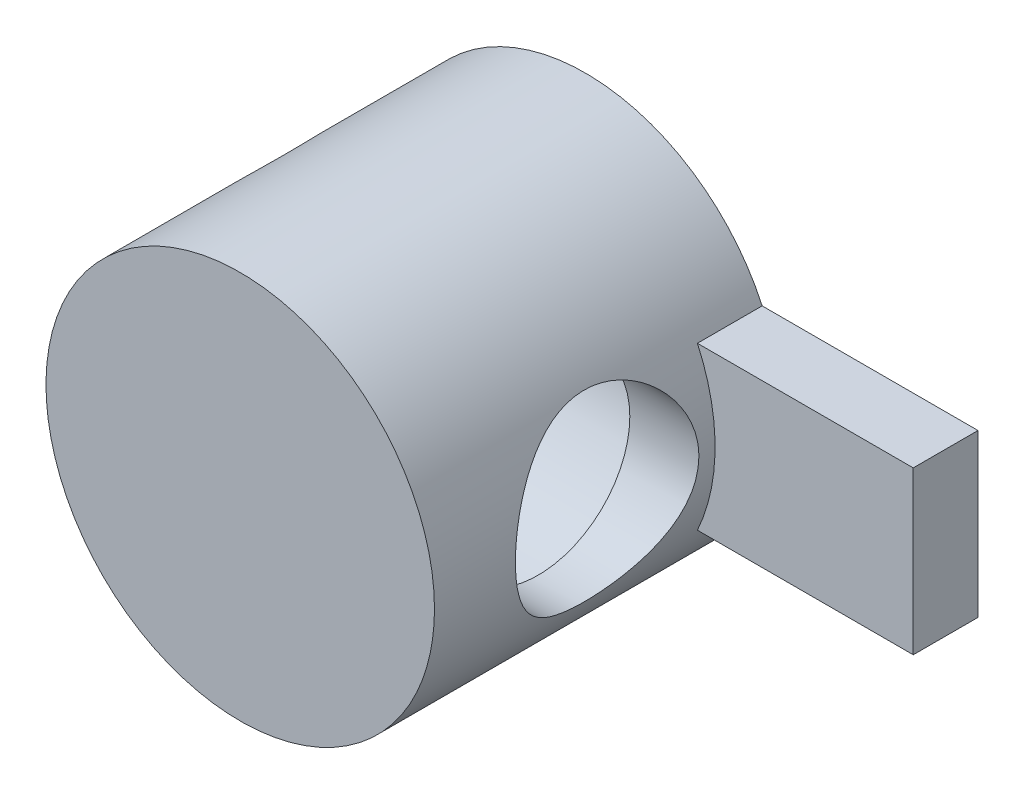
SolidWorks part; units mm, degrees
ref_plane "前视基准面" through (0, 0, 0) normal (0, 0, 1) x (1, 0, 0)
ref_plane "上视基准面" through (0, 0, 0) normal (0, 1, 0) x (1, 0, 0)
ref_plane "右视基准面" through (0, 0, 0) normal (1, 0, 0) x (0, 0, -1)
sketch "草图1" plane through (0, 0, 0) normal (0, 0, 1) x (1, 0, 0)
  circle A0 centre (0, 0) radius 9
  dimension "D1" = 18
extrude "凸台-拉伸1" add sketch "草图1" along normal mid plane 16
sketch "草图3" plane through (0, 0, -8) normal (0, 0, -1) x (-1, 0, 0)
  line L0 (0, 9) -> (0, -26.5793) construction
  line L1 (-16.154, 0) -> (26.2317, 0) construction
  line L4 (-8.1815, 3.75) -> (-18.1815, 3.75)
  line L5 (-18.1815, 3.75) -> (-18.1815, -3.75)
  line L6 (-18.1815, -3.75) -> (-8.1815, -3.75)
  circle A1 centre (0, 0) radius 9 construction
  arc A2 (-8.1815, 3.75) -> (-8.1815, -3.75) centre (0, 0) ccw
  dimension "D1" = 7.5
extrude "凸台-拉伸2" add sketch "草图3" against normal blind 3
sketch "草图4" plane through (0, 0, 0) normal (1, 0, 0) x (0, 0, -1)
  circle A0 centre (0, 0) radius 4.25
  dimension "D1" = 8.5
extrude "切除-拉伸1" cut sketch "草图4" against normal mid plane 20
sketch "草图5" plane through (0, 0, 0) normal (1, 0, 0) x (0, 0, -1)
  circle A0 centre (0, 0) radius 6.75
  dimension "D1" = 13.5
extrude "切除-拉伸2" cut sketch "草图5" against normal blind 20
sketch "草图6" plane through (0, 0, 0) normal (1, 0, 0) x (0, 0, -1)
  circle A0 centre (0, 0) radius 6.75
  dimension "D1" = 13.5
extrude "切除-拉伸3" cut sketch "草图6" along normal blind 5.8
